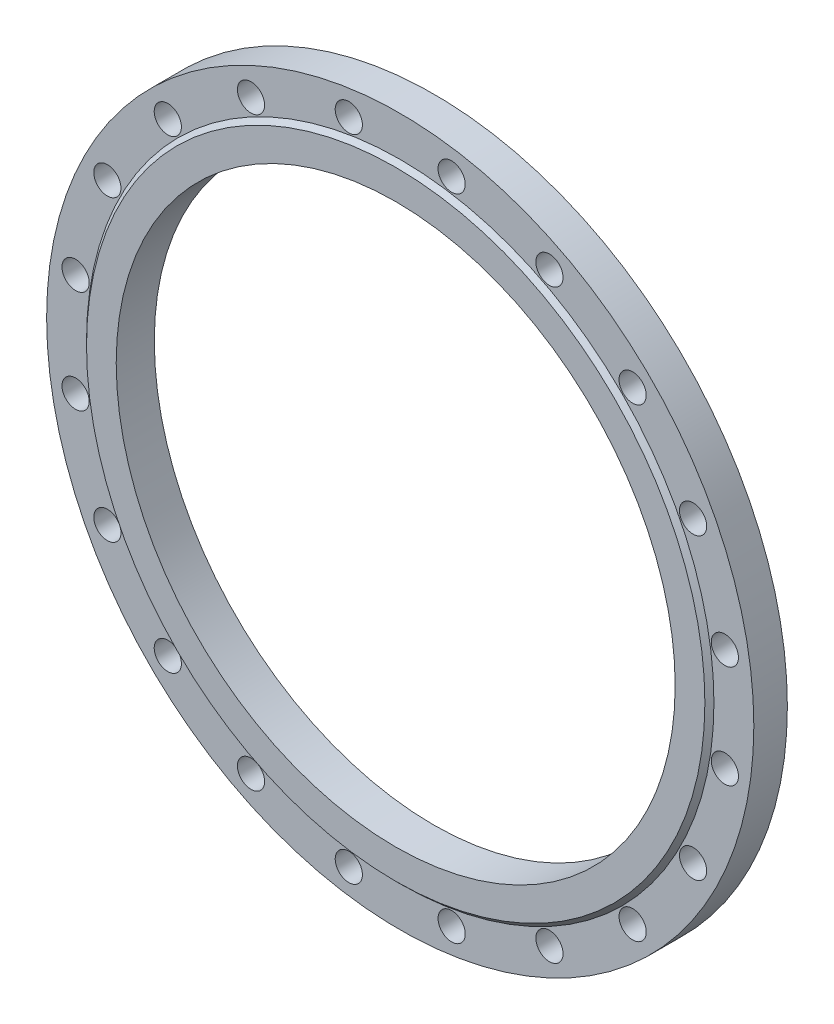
SolidWorks part; units mm, degrees
ref_plane "Plan de face" through (0, 0, 0) normal (0, 0, 1) x (1, 0, 0)
ref_plane "Plan de dessus" through (0, 0, 0) normal (0, 1, 0) x (1, 0, 0)
ref_plane "Plan de droite" through (0, 0, 0) normal (1, 0, 0) x (0, 0, -1)
sketch "Esquisse3" plane through (0, 0, 0) normal (1, 0, 0) x (0, 0, -1)
  line L0 (0, 0) -> (-318.7143, 0) construction
  line L1 (-8, 390) -> (29, 390)
  line L2 (-13, 341) -> (-13, 308.25)
  line L3 (-13, 308.25) -> (29, 308.25)
  line L4 (29, 390) -> (29, 308.25)
  line L5 (-13, 341) -> (-8, 346)
  line L6 (-8, 346) -> (-8, 390)
  dimension "D1" = 616.5
  dimension "D2" = 780
  dimension "D3" = 42
  dimension "D4" = 682
  dimension "D5" = 5
  dimension "D6" = 5
  dimension "D7" = 29
revolve "Révolution1" add sketch "Esquisse3" angle 360 about L0
sketch "Esquisse4" plane through (0, 0, 8) normal (0, 0, 1) x (1, 0, 0)
  line L0 (358.037, 56.7075) -> (0, 0) construction
  line L1 (0, 0) -> (390, 0) construction
  circle A0 centre (358.037, 56.7075) radius 15
  circle A1 centre (0, 0) radius 390 construction
  circle A2 centre (358.037, -56.7075) radius 15
  circle A3 centre (322.9899, -164.5716) radius 15
  circle A4 centre (256.3262, -256.3262) radius 15
  circle A5 centre (164.5716, -322.9899) radius 15
  circle A6 centre (56.7075, -358.037) radius 15
  circle A7 centre (-56.7075, -358.037) radius 15
  circle A8 centre (-164.5716, -322.9899) radius 15
  circle A9 centre (-256.3262, -256.3262) radius 15
  circle A10 centre (-322.9899, -164.5716) radius 15
  circle A11 centre (-358.037, -56.7075) radius 15
  circle A12 centre (-358.037, 56.7075) radius 15
  circle A13 centre (-322.9899, 164.5716) radius 15
  circle A14 centre (-256.3262, 256.3262) radius 15
  circle A15 centre (-164.5716, 322.9899) radius 15
  circle A16 centre (-56.7075, 358.037) radius 15
  circle A17 centre (56.7075, 358.037) radius 15
  circle A18 centre (164.5716, 322.9899) radius 15
  circle A19 centre (256.3262, 256.3262) radius 15
  circle A20 centre (322.9899, 164.5716) radius 15
  dimension "D2" = 30
  dimension "D1" = 9
  dimension "D3" = 362.5
extrude "Enlèv. mat.-Extru.1" cut sketch "Esquisse4" against normal through all
